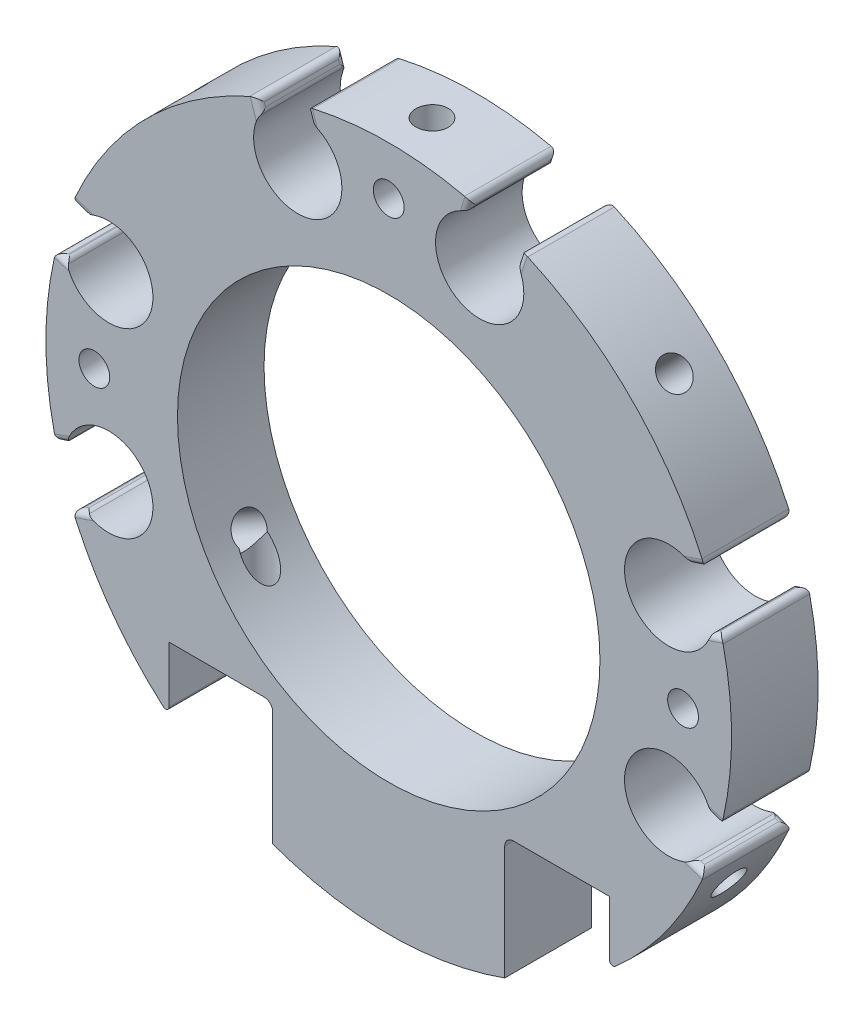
SolidWorks part; units mm, degrees
ref_plane "Front Plane" through (0, 0, 0) normal (0, 0, 1) x (1, 0, 0)
ref_plane "Top Plane" through (0, 0, 0) normal (0, 1, 0) x (1, 0, 0)
ref_plane "Right Plane" through (0, 0, 0) normal (1, 0, 0) x (0, 0, -1)
sketch "Sketch1" plane through (0, 0, 0) normal (0, 0, 1) x (1, 0, 0)
  line L0 (0, 0) -> (-25.146, 0) construction
  line L1 (0, 0) -> (12.573, 21.7771) construction
  line L2 (0, 0) -> (12.573, -21.7771) construction
  circle A0 centre (0, 0) radius 25.146
  dimension "D1" = 50.292
  dimension "D2" = 120
  dimension "D3" = 120
extrude "Boss-Extrude1" add sketch "Sketch1" along normal blind 6.35
sketch "Sketch2" plane through (0, 0, 6.35) normal (0, 0, 1) x (1, 0, 0)
  line L1 (-24.9185, -14.6395) -> (24.0391, -14.6395)
  line L2 (-24.9185, -14.6395) -> (-24.9185, -26.8241)
  line L3 (-24.9185, -26.8241) -> (24.0391, -26.8241)
  line L4 (24.0391, -14.6395) -> (24.0391, -26.8241)
extrude "Cut-Extrude1" cut sketch "Sketch2" against normal blind 4.7625
sketch "Sketch3" plane through (0, 0, 6.35) normal (0, 0, 1) x (1, 0, 0)
  line L1 (29.7951, -26.5733) -> (19.05, -26.5733)
  line L2 (29.7951, -26.5733) -> (29.7951, 23.8125)
  line L3 (29.7951, 23.8125) -> (19.05, 23.8125)
  line L4 (19.05, -26.5733) -> (19.05, 23.8125)
  dimension "D1" = 19.05
extrude "Cut-Extrude3" cut sketch "Sketch3" against normal blind 4.7625
sketch "Sketch5" plane through (0, 0, 6.35) normal (0, 0, 1) x (1, 0, 0)
  line L0 (16.1942, -14.6395) -> (16.1942, -19.2372)
  line L1 (19.05, -14.6395) -> (-20.4452, -14.6395) construction
  line L2 (19.05, -14.6395) -> (20.4452, -14.6395)
  line L3 (16.1942, -14.6395) -> (19.05, -14.6395)
  line L4 (-16.1067, -14.6395) -> (-16.1067, -19.3105)
  line L5 (-20.4452, -14.6395) -> (-16.1067, -14.6395)
  circle A0 centre (0, 0) radius 25.146 construction
  arc A1 (16.1942, -19.2372) -> (20.4452, -14.6395) centre (0, 0) ccw
  arc A2 (-16.1067, -19.3105) -> (-20.4452, -14.6395) centre (0, 0) cw
extrude "Boss-Extrude2" add sketch "Sketch5" against normal blind 4.7625
hole_wizard "#4-40 Tapped Hole1" positions "Sketch6" profile "Sketch7" tap size "#4-40" standard "ANSI Inch"
sketch "Sketch6" plane through (0, -14.6395, 0) normal (0, -1, 0) x (-1, 0, 0)
  line L0 (-16.1942, 0) -> (16.1067, 0) construction
  point P0 (12.7, -3.175)
  point P2 (-12.7, -3.175)
  dimension "D1" = 25.4
  dimension "D2" = 12.7
  dimension "D3" = 3.175
sketch "Sketch7" plane through (-12.7, -14.6395, 3.175) normal (1, 0, 0) x (0, 0, -1)
  line L0 (0, 0) -> (0, 13.3792)
  line L1 (0, 13.3792) -> (1.1303, 12.7)
  line L2 (1.1303, 12.7) -> (1.1303, 0)
  line L5 (1.1303, 0) -> (0, 0)
  line L10 (0, 13.3792) -> (-1.1303, 12.7) construction
  line L11 (0, -6.35) -> (0, 107.95) construction
  dimension "Tap Drill Dia." = 2.2606
  dimension "Tap Drill Depth" = 12.7
  dimension "Drill Angle" = 118
sketch "Sketch8" plane through (0, 0, 6.35) normal (0, 0, 1) x (1, 0, 0)
  line L0 (16.6168, 11.9363) -> (16.6168, 15.4391)
  line L3 (-19.2876, -11.9363) -> (16.6168, -11.9363)
  line L4 (16.6168, 11.9363) -> (16.6168, -11.9363)
  circle A0 centre (0, 0) radius 22.6823 construction
  arc A2 (16.6168, 15.4391) -> (-19.2876, -11.9363) centre (0, 0) ccw
  point P0 (0, 0)
extrude "Cut-Extrude4" [suppressed] cut sketch "Sketch8" against normal blind 6.35
sketch "Sketch9" plane through (0, 0, 6.35) normal (0, 0, 1) x (1, 0, 0)
  line L0 (-14.0723, 17.7892) -> (14.0723, 17.7892)
  circle A0 centre (0, 0) radius 22.6823 construction
  arc A1 (14.0723, 17.7892) -> (-14.0723, 17.7892) centre (0, 0) ccw
extrude "Boss-Extrude3" add sketch "Sketch9" against normal blind 6.35 separate body
combine bodies "Combine1" operation type add bodies to combine 105 107
sketch "Sketch12" plane through (0, 0, 6.35) normal (0, 0, 1) x (1, 0, 0)
  line L0 (19.05, 16.414) -> (19.05, -14.6395) construction
  line L1 (19.05, 16.414) -> (18.1261, 16.414)
  line L2 (18.1261, 16.414) -> (18.1261, -15.0455)
  line L3 (18.1261, -15.0455) -> (20.1483, -15.0455)
  arc A0 (19.05, 16.414) -> (20.1483, -15.0455) centre (0, 0) cw
extrude "Boss-Extrude4" add sketch "Sketch12" against normal up to surface (6.35 mm away)
mirror "Mirror1" about plane through (0, 0, 0) normal (1, 0, 0) of "Boss-Extrude4"
sketch "Sketch13" plane through (0, 0, 6.35) normal (0, 0, 1) x (1, 0, 0)
  line L0 (-16.51, 16.3128) -> (-16.51, -12.6861)
  line L2 (-16.51, -12.6861) -> (-19.239, -12.6541)
  line L3 (-19.239, -12.6541) -> (-19.239, 13.8267)
  line L4 (-19.239, 13.8267) -> (-16.51, 16.3128)
  dimension "D1" = 16.51
extrude "Boss-Extrude7" add sketch "Sketch13" against normal up to surface (6.35 mm away) contours L3 L4 L0 L2
ref_plane "Plane1" [suppressed] through (16.6168, -11.9363, 6.35) normal (1, 0, 0) x (0, 0, -1)
sketch "Sketch14" plane through (0, 0, 6.35) normal (0, 0, 1) x (1, 0, 0)
  line L0 (-17.8389, 15.24) -> (17.6266, 15.24)
  line L1 (17.6266, 15.24) -> (15.248, 17.2787)
  line L2 (15.248, 17.2787) -> (13.7912, 18.6451)
  line L3 (13.7912, 18.6451) -> (-12.9382, 18.6451)
  line L4 (-12.9382, 18.6451) -> (-16.0975, 17.0228)
  line L5 (-16.0975, 17.0228) -> (-17.8389, 15.24)
  dimension "D1" = 15.24
extrude "Boss-Extrude8" add sketch "Sketch14" against normal up to surface (6.35 mm away)
sketch "Sketch16" plane through (0, 0, 6.35) normal (0, 0, 1) x (1, 0, 0)
  line L1 (-16.51, 20.7015) -> (16.51, 20.7015)
  line L2 (-16.51, 20.7015) -> (-16.51, -12.3185)
  line L3 (-16.51, -12.3185) -> (16.51, -12.3185)
  line L4 (16.51, 20.7015) -> (16.51, -12.3185)
  line L5 (-16.51, 20.7015) -> (16.51, -12.3185) construction
  line L6 (-16.51, -12.3185) -> (16.51, 20.7015) construction
  point P0 (0, 4.1915)
  dimension "D1" = 33.02
  dimension "D2" = 33.02
hole_wizard "#4-40 Tapped Hole2" positions "Sketch10" profile "Sketch11" tap size "#4-40" standard "ANSI Inch"
sketch "Sketch10" plane through (0, 0, 6.35) normal (0, 0, 1) x (1, 0, 0)
  point P0 (0, 21.59)
  dimension "D1" = 21.59
sketch "Sketch11" plane through (0, 21.59, 6.35) normal (1, 0, 0) x (0, -1, 0)
  line L0 (0, 0) -> (0, 26.0792)
  line L1 (0, 26.0792) -> (1.1303, 25.4)
  line L2 (1.1303, 25.4) -> (1.1303, 0)
  line L5 (1.1303, 0) -> (0, 0)
  line L10 (0, 26.0792) -> (-1.1303, 25.4) construction
  line L11 (0, -6.35) -> (0, 107.95) construction
  dimension "Tap Drill Dia." = 2.2606
  dimension "Tap Drill Depth" = 25.4
  dimension "Drill Angle" = 118
pattern_circular "CirPattern1" count 4 over 360 about axis through (0, 0, 0) along (0, 0, 1) of "#4-40 Tapped Hole2"
pattern_circular "CirPattern2" count 2 every 18 about axis through (0, 0, 0) along (0, 0, 1) of "CirPattern1", "#4-40 Tapped Hole2"
pattern_circular "CirPattern3" count 2 every 18 about axis through (0, 0, 0) along (0, 0, 1) of "CirPattern1", "#4-40 Tapped Hole2"
fillet "Fillet7" [suppressed] radius 2.54
sketch "Sketch18" plane through (0, 0, 1.5875) normal (0, 0, 1) x (1, 0, 0)
  line L1 (-16.1067, -14.6395) -> (16.1942, -14.6395)
  line L2 (-16.1067, -14.6395) -> (-16.1067, -26.8579)
  line L3 (-16.1067, -26.8579) -> (16.1942, -26.8579)
  line L4 (16.1942, -14.6395) -> (16.1942, -26.8579)
extrude "Cut-Extrude5" cut sketch "Sketch18" against normal through all
fillet "Fillet2" radius 0.254 2 edges at (16.1942, -19.2372, 3.175) (-16.1067, -19.3105, 3.175)
ref_plane "Plane3" through (0, 0, 3.175) normal (0, 0, 1) x (1, 0, 0)
sketch "Sketch21" plane through (0, 0, 3.175) normal (0, 0, 1) x (1, 0, 0)
  line L0 (0, 0) -> (0, 28.5364)
  line L1 (0, 0) -> (0, 30.0835) construction
  dimension "D1" = 0
ref_plane "Plane2" through (0, 28.5364, 3.175) normal (0, 1, 0) x (1, 0, 0)
hole_wizard "#4-48 Tapped Hole1" positions "Sketch19" profile "Sketch20" tap size "#4-48" standard "ANSI Inch"
sketch "Sketch19" plane through (0, 28.5364, 3.175) normal (0, 1, 0) x (1, 0, 0)
  point P0 (0, 0)
  dimension "D1" = 3.175
sketch "Sketch20" plane through (0, 28.5364, 3.175) normal (1, 0, 0) x (0, 0, 1)
  line L0 (0, 0) -> (0, 19.7635)
  line L1 (0, 19.7635) -> (1.1874, 19.05)
  line L2 (1.1874, 19.05) -> (1.1874, 0)
  line L5 (1.1874, 0) -> (0, 0)
  line L10 (0, 19.7635) -> (-1.1875, 19.05) construction
  line L11 (0, -6.35) -> (0, 107.95) construction
  dimension "Tap Drill Dia." = 2.3749
  dimension "Tap Drill Depth" = 19.05
  dimension "Drill Angle" = 118
pattern_circular "CirPattern4" count 3 over 360 about axis through (0, 0, 6.35) along (0, 0, -1) of "#4-48 Tapped Hole1"
sketch "Sketch22" plane through (0, 0, 6.35) normal (0, 0, 1) x (1, 0, 0)
  circle A0 centre (0, 0) radius 15.494
  arc A1 (16.616, -18.874) -> (-16.5276, -18.9515) centre (0, 0) ccw construction
  point P7 (0, 0)
  dimension "D1" = 30.988
extrude "Cut-Extrude6" cut sketch "Sketch22" against normal up to surface (6.35 mm away)
fillet "Fillet8" radius 0.635 1 edges at (5.0743, -14.6395, 3.175)
sketch "Sketch23" plane through (0, 0, 6.35) normal (0, 0, 1) x (1, 0, 0)
  circle A0 centre (-6.6717, 20.5333) radius 3.2385
  dimension "D1" = 6.477
extrude "Cut-Extrude7" cut sketch "Sketch23" against normal blind 8.89
sketch "Sketch24" plane through (0, 0, 6.35) normal (0, 0, 1) x (1, 0, 0)
  line L0 (-6.4244, 25.5297) -> (-5.4523, 22.6134)
  line L5 (-5.4523, 22.6134) -> (-9.1409, 21.3839)
  line L6 (-9.1409, 21.3839) -> (-10.1129, 24.3002)
  line L7 (-10.1129, 24.3002) -> (-6.4244, 25.5297)
extrude "Cut-Extrude8" cut sketch "Sketch24" against normal blind 8.89
pattern_circular "CirPattern5" count 4 over 360 about axis through (0, 0, 0) along (0, 0, 1) of "Cut-Extrude8", "Cut-Extrude7"
mirror "Mirror2" about plane through (0, 0, 0) normal (1, 0, 0) of "CirPattern5", "Cut-Extrude7", "Cut-Extrude8"
sketch "Sketch25" plane through (0, 0, 3.175) normal (0, 0, 1) x (1, 0, 0)
  line L0 (0, 0) -> (-22.1707, 22.1707)
  line L1 (0, 0) -> (0, 28.5364) construction
  dimension "D1" = 31.3542
  dimension "D2" = 45
ref_plane "Plane4" through (-22.1707, 22.1707, 3.175) normal (-0.7071, 0.7071, 0) x (0, 0, 1)
hole_wizard "#4-40 Tapped Hole4" positions "Sketch26" profile "Sketch27" tap size "#4-40" standard "ANSI Inch"
sketch "Sketch26" plane through (-22.1707, 22.1707, 3.175) normal (-0.7071, 0.7071, 0) x (0, 0, 1)
  line L0 (0, 0) -> (0, 20.1783) construction
  point P0 (0, 0)
sketch "Sketch27" plane through (-22.1707, 22.1707, 3.175) normal (0, 0, 1) x (-0.7071, -0.7071, 0)
  line L0 (0, 0) -> (0, 19.7292)
  line L1 (0, 19.7292) -> (1.1303, 19.05)
  line L2 (1.1303, 19.05) -> (1.1303, 0)
  line L5 (1.1303, 0) -> (0, 0)
  line L10 (0, 19.7292) -> (-1.1303, 19.05) construction
  line L11 (0, -6.35) -> (0, 107.95) construction
  dimension "Tap Drill Dia." = 2.2606
  dimension "Tap Drill Depth" = 19.05
  dimension "Drill Angle" = 118
pattern_circular "CirPattern6" count 4 over 360 about axis through (0, 0, 6.35) along (0, 0, -1) of "#4-40 Tapped Hole4"
sketch "Sketch28" plane through (0, 0, 6.35) normal (0, 0, 1) x (1, 0, 0)
  line L2 (-8.509, -12.9484) -> (-8.509, -23.6626)
  line L4 (8.509, -12.9484) -> (8.509, -23.6626)
  circle A0 centre (0, 0) radius 25.146 construction
  arc A1 (-8.509, -23.6626) -> (8.509, -23.6626) centre (0, 0) ccw
  circle A2 centre (0, 0) radius 15.494 construction
  arc A3 (7.6861, -13.4532) -> (-7.6861, -13.4532) centre (0, 0) ccw construction
  arc A4 (-8.509, -12.9484) -> (8.509, -12.9484) centre (0, 0) ccw
  dimension "D3" = 50.292
  dimension "D4" = 30.988
  dimension "D1" = 17.018
  dimension "D2" = 8.509
extrude "Boss-Extrude9" add sketch "Sketch28" against normal up to surface (6.35 mm away)
fillet "Fillet10" radius 0.635 2 edges at (8.509, -14.6395, 3.175) (-8.509, -14.6395, 3.175)
fillet "Fillet11" radius 0.4572 48 edges at (-9.4254, 22.2376, 3.175) (-5.7984, 23.6519, 3.175) (-5.9243, 24.0296, 0) (-6.0502, 24.4073, 3.175) (-9.7405, 23.1828, 3.175) (-9.583, 22.7102, 0) (-9.583, 22.7102, 6.35) (-5.9243, 24.0296, 6.35) (22.2376, 9.4254, 3.175) (23.6519, 5.7984, 3.175) (-22.2376, -9.4254, 3.175) (-23.6519, -5.7984, 3.175) (24.0296, 5.9243, 0) (24.4073, 6.0502, 3.175) (23.1828, 9.7405, 3.175) (22.7102, 9.583, 0) (22.7102, 9.583, 6.35) (24.0296, 5.9243, 6.35) (-24.0296, -5.9243, 0) (-24.4073, -6.0502, 3.175) (-23.1828, -9.7405, 3.175) (-22.7102, -9.583, 0) (-22.7102, -9.583, 6.35) (-24.0296, -5.9243, 6.35) (5.7984, 23.6519, 3.175) (9.4254, 22.2376, 3.175) (-23.6519, 5.7984, 3.175) (-22.2376, 9.4254, 3.175) (23.6519, -5.7984, 3.175) (22.2376, -9.4254, 3.175) (9.583, 22.7102, 6.35) (5.9243, 24.0296, 6.35) (9.7405, 23.1828, 3.175) (9.583, 22.7102, 0) (5.9243, 24.0296, 0) (6.0502, 24.4073, 3.175) (-22.7102, 9.583, 6.35) (-24.0296, 5.9243, 6.35) (-23.1828, 9.7405, 3.175) (-22.7102, 9.583, 0) (-24.0296, 5.9243, 0) (-24.4073, 6.0502, 3.175) (22.7102, -9.583, 6.35) (24.0296, -5.9243, 6.35) (23.1828, -9.7405, 3.175) (22.7102, -9.583, 0) (24.0296, -5.9243, 0) (24.4073, -6.0502, 3.175)
